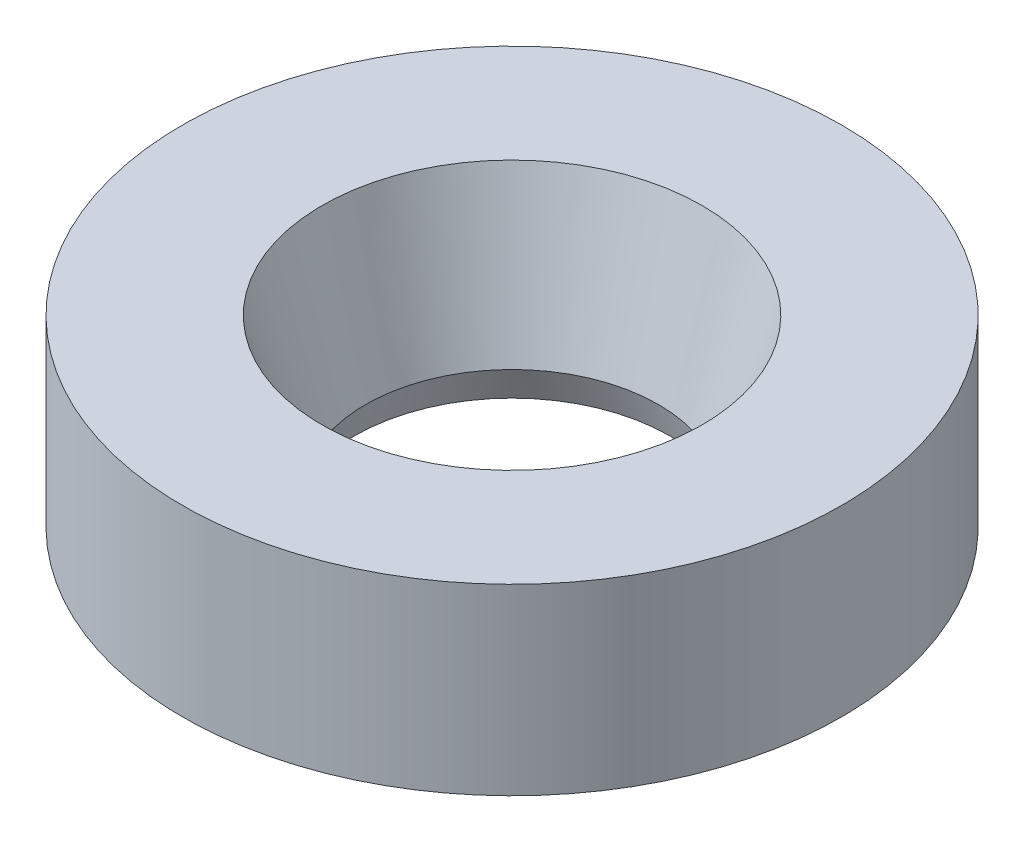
SolidWorks part; units mm, degrees
ref_plane "Front Plane" through (0, 0, 0) normal (0, 0, 1) x (1, 0, 0)
ref_plane "Top Plane" through (0, 0, 0) normal (0, 1, 0) x (1, 0, 0)
ref_plane "Right Plane" through (0, 0, 0) normal (1, 0, 0) x (0, 0, -1)
sketch "Sketch1" plane through (0, 0, 0) normal (0, 0, 1) x (1, 0, 0)
  line L0 (4.3002, 0) -> (8.9992, 0)
  line L1 (8.9992, 0) -> (8.9992, 5.0013)
  line L2 (8.9992, 5.0013) -> (5.1892, 5.0013)
  line L3 (4.0005, 0.889) -> (4.3002, 0)
  line L4 (0, 0) -> (0, 8.0108) construction
  line L5 (4.0005, 0.889) -> (5.1892, 5.0013)
  dimension "D2" = 4.699
revolve "Revolve1" add sketch "Sketch1" angle 360 about L4
